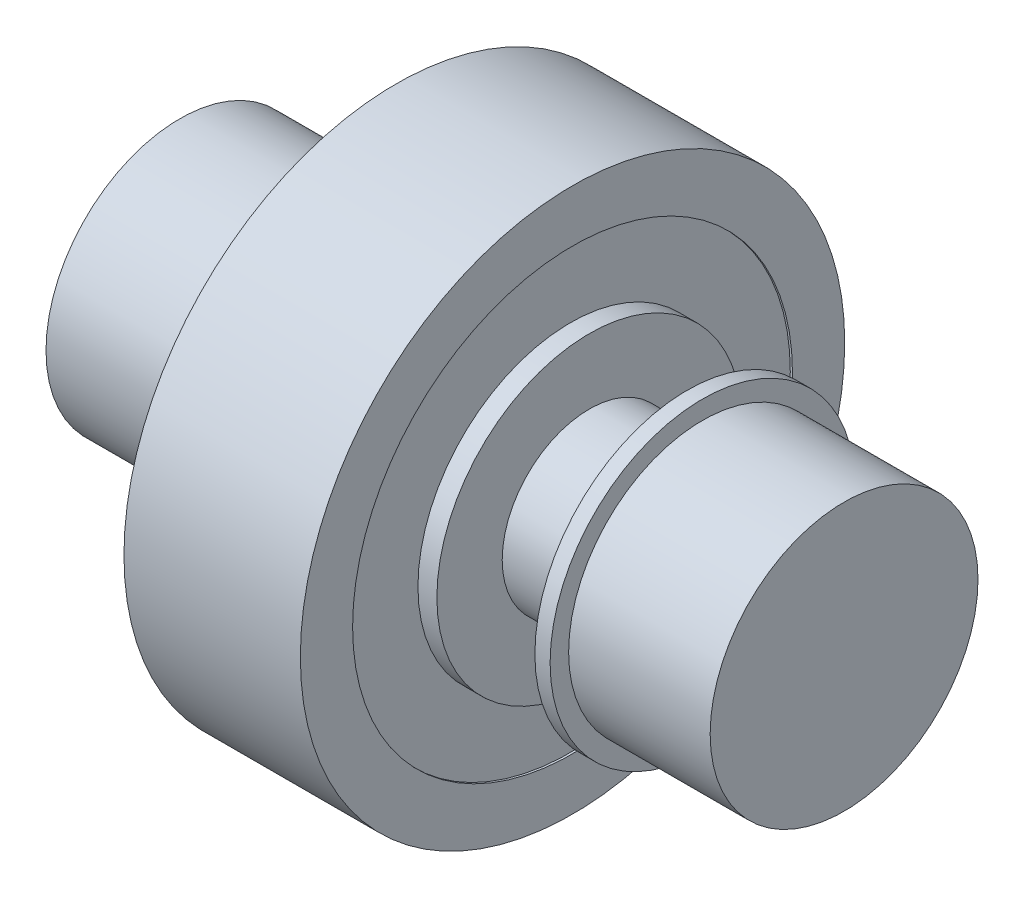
SolidWorks part; units mm, degrees
ref_plane "Piano frontale" through (0, 0, 0) normal (0, 0, 1) x (1, 0, 0)
ref_plane "Piano superiore" through (0, 0, 0) normal (0, 1, 0) x (1, 0, 0)
ref_plane "Piano destro" through (0, 0, 0) normal (1, 0, 0) x (0, 0, -1)
sketch "Schizzo1" plane through (0, 0, 0) normal (0, 0, 1) x (1, 0, 0)
  line L0 (-1716.3243, 0) -> (84099.8918, 0) construction
  line L1 (-152.5, 0) -> (152.5, 0)
  line L2 (-152.5, 0) -> (-152.5, 61.5)
  line L3 (-152.5, 61.5) -> (-44.5, 61.5)
  line L4 (152.5, 0) -> (152.5, 61.5)
  line L5 (152.5, 61.5) -> (87.5, 61.5)
  line L6 (-44.5, 61.5) -> (-44.5, 101)
  line L7 (-44.5, 101) -> (26.8, 101)
  line L10 (26.8, 70) -> (35.5, 70)
  line L11 (35.5, 70) -> (35.5, 40)
  line L15 (80.5, 40) -> (80.5, 70)
  line L16 (80.5, 70) -> (87.5, 70)
  line L17 (87.5, 70) -> (87.5, 61.5)
  line L19 (35.5, 40) -> (80.5, 40)
  line L20 (26.8, 101) -> (26.8, 70)
  point P6 (0, 0)
  dimension "D1" = 305
  dimension "D2" = 61.5
  dimension "D3" = 108
  dimension "D5" = 39.5
  dimension "D6" = 7
  dimension "D7" = 30
  dimension "D8" = 8.7
  dimension "D9" = 45
  dimension "D10" = 65
  dimension "D11" = 40
revolve "Rivoluzione1" add sketch "Schizzo1" angle 360 about L0
sketch "Schizzo3" plane through (0, 0, 0) normal (0, 0, 1) x (1, 0, 0)
  line L0 (152.5, 0) -> (-152.5, 0) construction
  line L1 (-152.5, 61.5) -> (-152.5, -61.5) construction
  point P6 (0, 0)
sketch "Schizzo4" plane through (0, 0, 0) normal (0, 0, 1) x (1, 0, 0)
  line L1 (-44.5, 0) -> (-44.5, 101)
  line L2 (-44.5, 101) -> (-44.5, -101) construction
  line L3 (-44.5, 101) -> (-53.2, 101)
  line L4 (-53.2, 101) -> (-53.2, 125)
  line L5 (-53.2, 125) -> (27.8, 125)
  line L7 (152.5, 0) -> (-152.5, 0) construction
  line L9 (-44.5, 0) -> (26.8, 0)
  line L10 (26.8, -101) -> (26.8, 101) construction
  line L11 (26.8, 0) -> (26.8, 101)
  line L12 (26.8, 101) -> (27.8, 101)
  line L13 (27.8, 101) -> (27.8, 125)
  dimension "D1" = 125
  dimension "D2" = 8.7
  dimension "D3" = 1
  dimension "D4" = 101
revolve "Rivoluzione2" add sketch "Schizzo4" angle 360 about L0
ref_point "Punto1"
